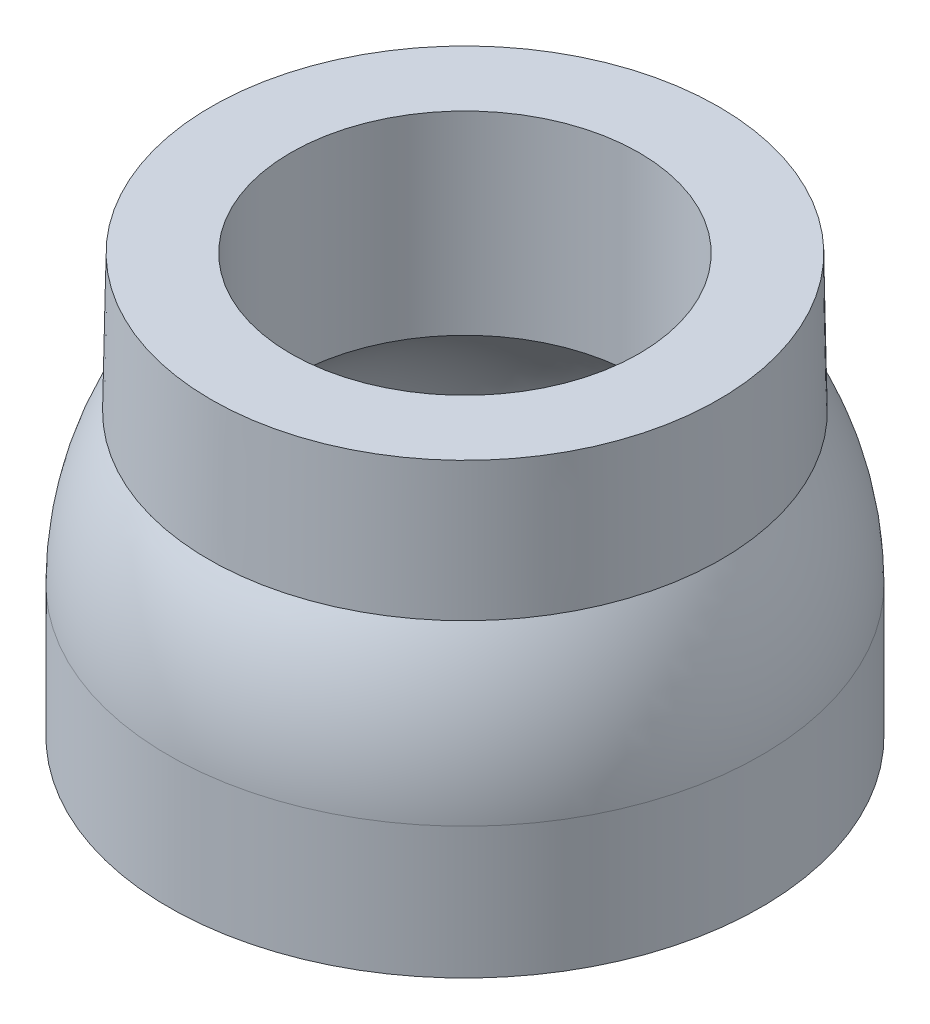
SolidWorks part; units mm, degrees
ref_plane "Front Plane" through (0, 0, 0) normal (0, 0, 1) x (1, 0, 0)
ref_plane "Top Plane" through (0, 0, 0) normal (0, 1, 0) x (1, 0, 0)
ref_plane "Right Plane" through (0, 0, 0) normal (1, 0, 0) x (0, 0, -1)
sketch "Sketch1" plane through (0, 0, 0) normal (0, 0, 1) x (1, 0, 0)
  line L0 (7, 0) -> (0, 0)
  line L1 (0, 0) -> (0, 7)
  arc A0 (0, 7) -> (7, 0) centre (0, 0) cw
revolve "Revolve1" [suppressed] add sketch "Sketch1" angle 360 about L1
sketch "Sketch2" plane through (0, 0, 0) normal (0, 1, 0) x (1, 0, 0)
  line L1 (-13, -13) -> (13, -13)
  line L2 (-13, -13) -> (-13, 13)
  line L3 (-13, 13) -> (13, 13)
  line L4 (13, -13) -> (13, 13)
  line L5 (-13, -13) -> (13, 13) construction
  line L6 (-13, 13) -> (13, -13) construction
  point P0 (0, 0)
extrude "Boss-Extrude1" [suppressed] add sketch "Sketch2" against normal blind 4
sketch "Sketch3" plane through (0, 0, 0) normal (0, 1, 0) x (1, 0, 0)
  circle A0 centre (0, 0) radius 8
  circle A1 centre (0, 0) radius 10
extrude "Cut-Extrude1" [suppressed] cut sketch "Sketch3" against normal blind 2
sketch "Sketch4" plane through (0, 0, 0) normal (0, 1, 0) x (1, 0, 0)
  circle A0 centre (-3.5672, 0) radius 1
extrude "Cut-Extrude2" [suppressed] cut sketch "Sketch4" along normal blind 12
sketch "Sketch6" plane through (0, 0, 0) normal (0, 0, 1) x (1, 0, 0)
  line L4 (-0.0551, 0.2426) -> (-0.0551, 13.2701) construction
  line L6 (7.9449, 0.2426) -> (7.9449, -1.7527)
  line L7 (7.9449, -1.7527) -> (9.8449, -1.7527)
  line L8 (9.8449, 2.6407) -> (9.8449, -1.7527)
  line L9 (5.7635, 12.222) -> (8.4231, 12.222)
  line L12 (8.4231, 12.222) -> (8.5057, 7.6397)
  line L13 (5.7635, 12.222) -> (5.7635, 5.7329)
  arc A0 (5.7635, 5.7329) -> (7.9449, 0.2426) centre (-0.0551, 0.2426) cw
  arc A1 (8.5057, 7.6397) -> (9.8449, 2.6407) centre (-0.1551, 2.6407) cw
  arc A2 (-0.1551, 12.6407) -> (9.8449, 2.6407) centre (-0.1551, 2.6407) cw construction
  arc A3 (-0.0551, 8.2426) -> (7.9449, 0.2426) centre (-0.0551, 0.2426) cw construction
revolve "Revolve2" add sketch "Sketch6" angle 360 about L4
